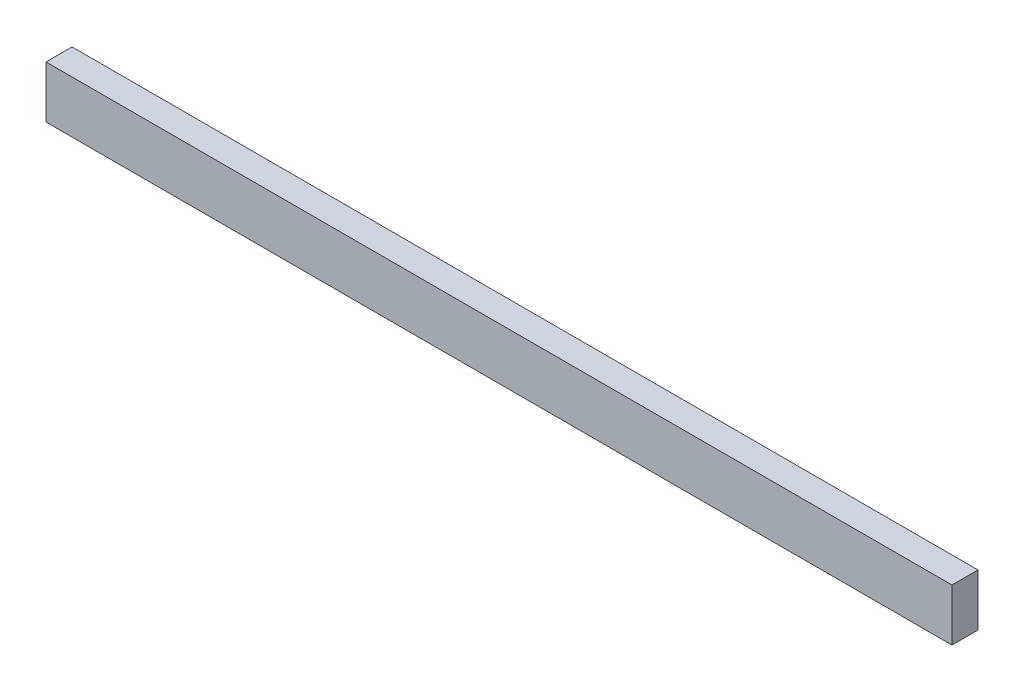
SolidWorks part; units mm, degrees
ref_plane "Front Plane" through (0, 0, 0) normal (0, 0, 1) x (1, 0, 0)
ref_plane "Top Plane" through (0, 0, 0) normal (0, 1, 0) x (1, 0, 0)
ref_plane "Right Plane" through (0, 0, 0) normal (1, 0, 0) x (0, 0, -1)
sketch "Sketch1" plane through (0, 0, 0) normal (0, 0, 1) x (1, 0, 0)
  line L1 (-435, 25) -> (435, 25)
  line L2 (-435, 25) -> (-435, -25)
  line L3 (-435, -25) -> (435, -25)
  line L4 (435, 25) -> (435, -25)
  line L5 (-435, 25) -> (435, -25) construction
  line L6 (-435, -25) -> (435, 25) construction
  point P0 (0, 0)
  dimension "D1" = 870
  dimension "D2" = 50
extrude "Boss-Extrude1" add sketch "Sketch1" along normal blind 25
